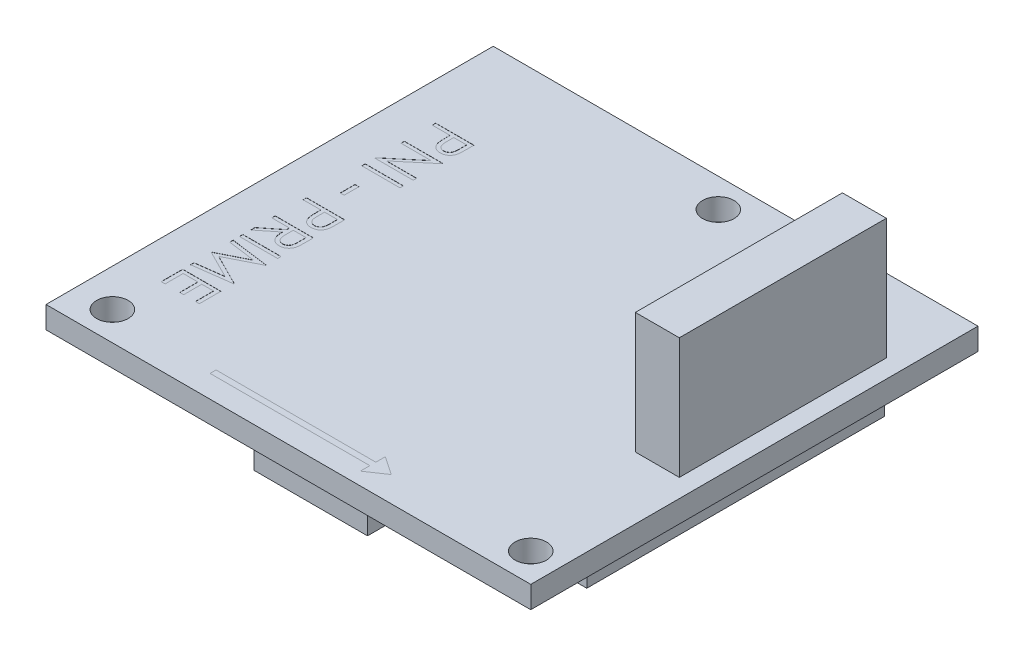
SolidWorks part; units mm, degrees
ref_plane "Front Plane" through (0, 0, 0) normal (0, 0, 1) x (1, 0, 0)
ref_plane "Top Plane" through (0, 0, 0) normal (0, 1, 0) x (1, 0, 0)
ref_plane "Right Plane" through (0, 0, 0) normal (1, 0, 0) x (0, 0, -1)
sketch "Sketch1" plane through (0, 0, 0) normal (0, 1, 0) x (1, 0, 0)
  line L0 (-16.8, 15.5) -> (16.8, -15.5) construction
  line L1 (-16.8, 15.5) -> (16.8, 15.5)
  line L2 (-16.8, 15.5) -> (-16.8, -15.5)
  line L3 (-16.8, -15.5) -> (16.8, -15.5)
  line L4 (16.8, 15.5) -> (16.8, -15.5)
  circle A0 centre (0.8, 13.5) radius 1.0922
  circle A1 centre (14.8, -13.5) radius 1.0922
  circle A2 centre (-14.2, -13.5) radius 1.0922
  dimension "D3" = 2.1844
  dimension "D4" = 2
  dimension "D6" = 2
  dimension "D7" = 2.6
  dimension "D8" = 0.9078
  dimension "D9" = 29
  dimension "D10" = 17.6
  dimension "D11" = 27
  dimension "31.0" = 31
  dimension "D2" = 33.6
extrude "Boss-Extrude1" add sketch "Sketch1" along normal blind 1.524
sketch "Sketch2" plane through (0, 1.524, 0) normal (0, 1, 0) x (1, 0, 0)
  line L0 (16.8, -15.5) -> (16.8, 15.5) construction
  line L1 (15.53, 10.42) -> (12.482, 10.42)
  line L2 (15.53, 10.42) -> (15.53, -3.931)
  line L3 (15.53, -3.931) -> (12.482, -3.931)
  line L4 (12.482, 10.42) -> (12.482, -3.931)
  line L5 (16.8, 15.5) -> (-16.8, 15.5) construction
  dimension "D1" = 1.27
  dimension "D2" = 3.048
  dimension "D3" = 5.08
  dimension "D4" = 14.351
extrude "Boss-Extrude2" add sketch "Sketch2" along normal blind 8.382
sketch "Sketch3" plane through (0, 0, 0) normal (0, -1, 0) x (1, 0, 0)
  line L0 (15.5531, -10.2816) -> (2.4505, -10.2816)
  line L1 (2.4505, -10.2816) -> (2.4505, -9.8892)
  line L2 (2.4505, -9.8892) -> (-3.2378, -9.8892)
  line L3 (-3.2378, -9.8892) -> (-3.2378, -10.5465)
  line L4 (-3.2378, -10.5465) -> (-15.5422, -10.5465)
  line L5 (-15.5422, -10.5465) -> (-15.5422, 7.3136)
  line L6 (-15.5422, 7.3136) -> (-3.0581, 7.3136)
  line L7 (-3.0581, 7.3136) -> (-3.0581, 14.8237)
  line L8 (-3.0581, 14.8237) -> (4.8087, 14.8237)
  line L9 (4.8087, 14.8237) -> (4.8087, 10.3697)
  line L10 (4.8087, 10.3697) -> (15.5531, 10.3697)
  line L11 (15.5531, 10.3697) -> (15.5531, -10.2816)
extrude "Boss-Extrude3" add sketch "Sketch3" along normal blind 1.9
sketch "Sketch4" plane through (0, 0, 0) normal (0, 1, 0) x (1, 0, 0)
  line L0 (16.8, -15.5) -> (16.8, 15.5) construction
  line L5 (-16.8, 15.5) -> (-16.8, -15.5)
  line L6 (-16.8, -15.5) -> (16.8, -15.5)
  line L7 (16.8, -15.5) -> (16.8, 15.5)
  line L8 (16.8, 15.5) -> (-16.8, 15.5)
  line L9 (-16.8, 15.5) -> (-16.8, -15.5)
  line L10 (-16.8, -15.5) -> (16.8, -15.5)
  line L11 (16.8, -15.5) -> (16.8, 15.5)
  line L12 (16.8, 15.5) -> (-16.8, 15.5)
  point P0 (14.8, -13.5)
  point P1 (-14.2, -13.5)
  point P3 (0.8, 13.5)
  dimension "D1" = 2
  dimension "D2" = 29
  dimension "D3" = 16
  dimension "D4" = 27
  dimension "D5" = 0
sketch "Sketch5" plane through (0, -1.9, 0) normal (0, -1, 0) x (1, 0, 0)
  line L24 (12.4718, -7.2003) -> (12.4718, 7.2884)
  line L25 (12.4718, 7.2884) -> (1.7274, 7.2884)
  line L26 (1.7274, 7.2884) -> (1.7274, 11.7425)
  line L27 (1.7274, 11.7425) -> (0.0232, 11.7425)
  line L28 (0.0232, 11.7425) -> (0.0232, 4.2324)
  line L29 (0.0232, 4.2324) -> (-12.4609, 4.2324)
  line L30 (-12.4609, 4.2324) -> (-12.4609, -7.4652)
  line L31 (-12.4609, -7.4652) -> (-6.3191, -7.4652)
  line L32 (-6.3191, -7.4652) -> (-6.3191, -6.8079)
  line L33 (-6.3191, -6.8079) -> (5.5318, -6.8079)
  line L34 (5.5318, -6.8079) -> (5.5318, -7.2003)
  line L35 (5.5318, -7.2003) -> (12.4718, -7.2003)
  line L36 (12.4718, -7.2003) -> (12.4718, 7.2884)
  line L37 (12.4718, 7.2884) -> (1.7274, 7.2884)
  line L38 (1.7274, 7.2884) -> (1.7274, 11.7425)
  line L39 (1.7274, 11.7425) -> (0.0232, 11.7425)
  line L40 (0.0232, 11.7425) -> (0.0232, 4.2324)
  line L41 (0.0232, 4.2324) -> (-12.4609, 4.2324)
  line L42 (-12.4609, 4.2324) -> (-12.4609, -7.4652)
  line L43 (-12.4609, -7.4652) -> (-6.3191, -7.4652)
  line L44 (-6.3191, -7.4652) -> (-6.3191, -6.8079)
  line L45 (-6.3191, -6.8079) -> (5.5318, -6.8079)
  line L46 (5.5318, -6.8079) -> (5.5318, -7.2003)
  line L47 (5.5318, -7.2003) -> (12.4718, -7.2003)
  dimension "D1" = 3.0812
extrude "Cut-Extrude1" cut sketch "Sketch5" against normal blind 1.04
sketch "Sketch6" plane through (0, 1.524, 0) normal (0, 1, 0) x (1, 0, 0)
  line L0 (4.098, -13.7441) -> (5.3783, -13.7441) construction
  line L1 (-6.9767, -13.5367) -> (4.098, -13.5367)
  line L2 (-6.9767, -13.5367) -> (-6.9767, -13.9516)
  line L3 (-6.9767, -13.9516) -> (4.098, -13.9516)
  line L4 (4.098, -13.5367) -> (4.098, -13.9516) construction
  line L5 (5.3783, -13.7441) -> (4.098, -12.877)
  line L6 (5.3783, -13.7441) -> (4.098, -14.6112)
  line L7 (4.098, -14.6112) -> (4.098, -13.9516)
  line L8 (4.098, -12.877) -> (4.098, -13.5367)
sketch "Sketch7" plane through (0, 1.524, 0) normal (0, 1, 0) x (1, 0, 0)
  line L0 (-14.177, -10.2748) -> (-14.177, 12.2969) construction
  text T0 "PNI - PRIME" font "Century Gothic" height in points 10
extrude "Cut-Extrude2" cut sketch "Sketch7" against normal blind 0.01
equation "\"Buoyancy\"=\"SW-Volume\"*(\"SW-Density\"-.037062)"
